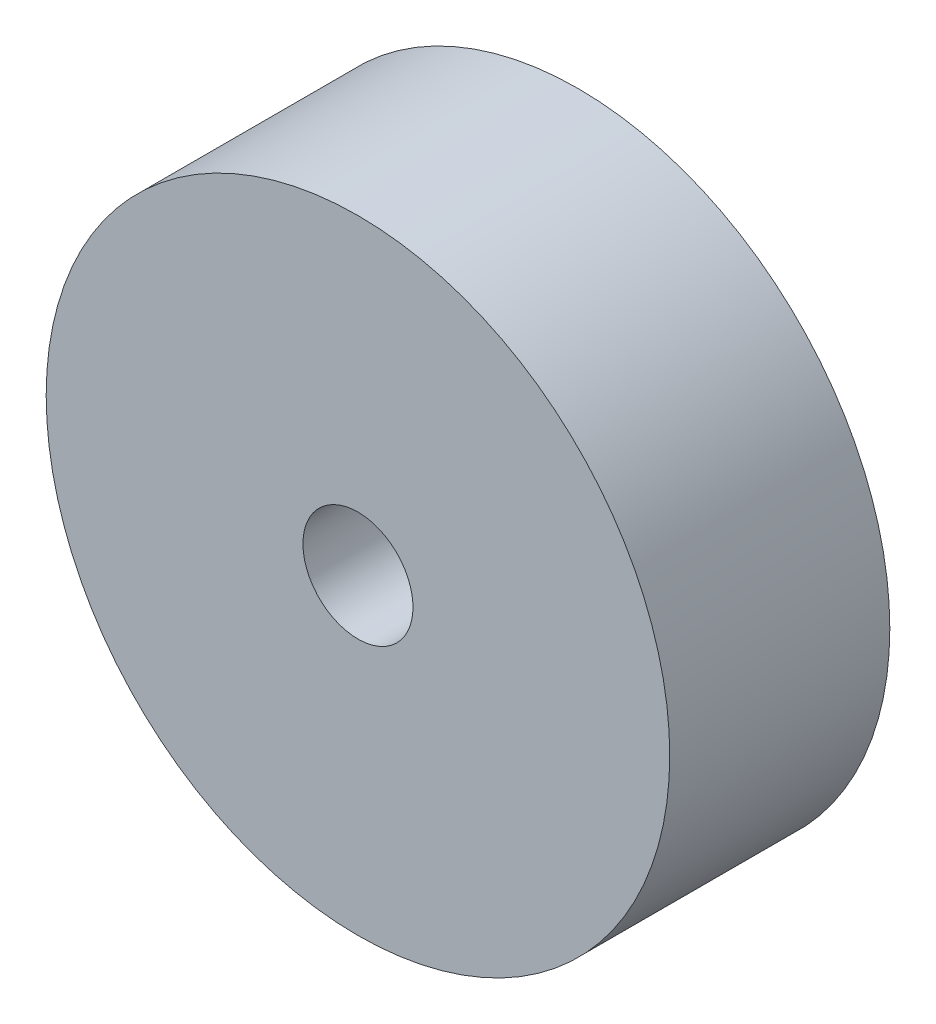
SolidWorks part; units mm, degrees
ref_plane "前视" through (0, 0, 0) normal (0, 0, 1) x (1, 0, 0)
ref_plane "上视" through (0, 0, 0) normal (0, 1, 0) x (1, 0, 0)
ref_plane "右视" through (0, 0, 0) normal (1, 0, 0) x (0, 0, -1)
sketch "草图1" plane through (0, 0, 0) normal (0, 0, 1) x (1, 0, 0)
  circle A0 centre (0, 0) radius 17
extrude "凸台-拉伸1" add sketch "草图1" along normal blind 12
sketch "草图2" plane through (0, 0, 0) normal (0, 0, -1) x (-1, 0, 0)
  circle A0 centre (0, 0) radius 3
extrude "切除-拉伸1" cut sketch "草图2" against normal blind 12
